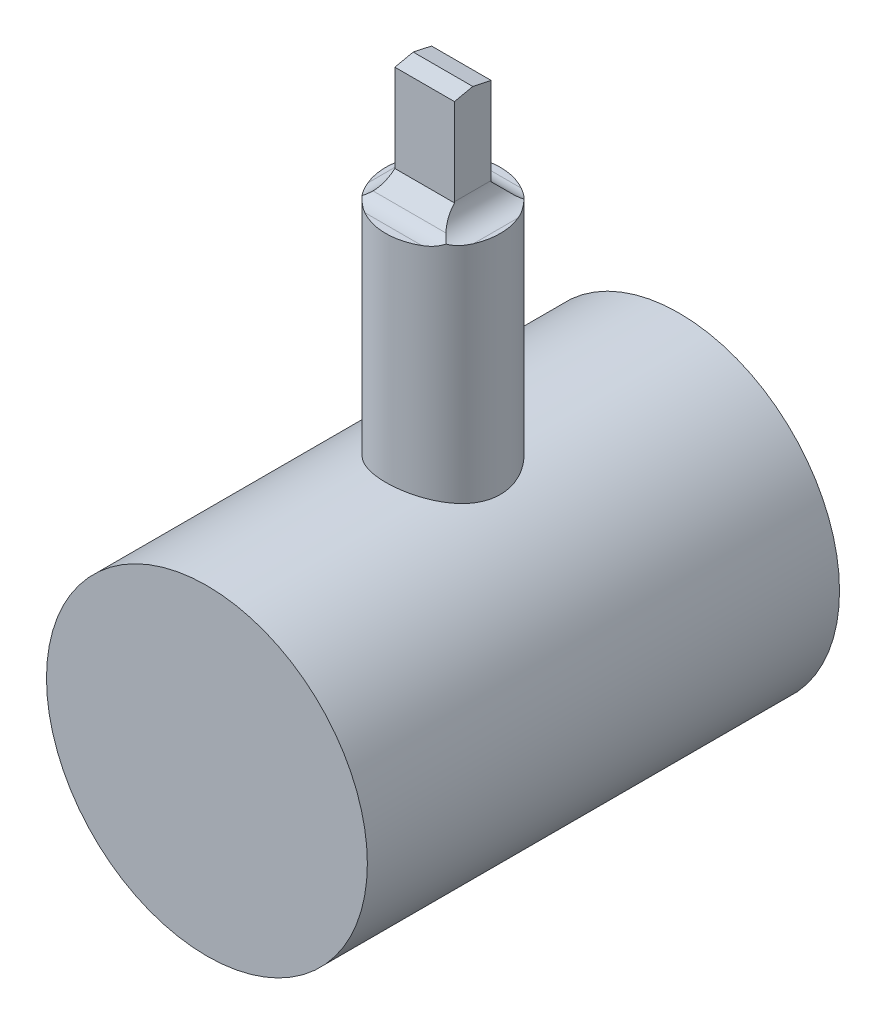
SolidWorks part; units mm, degrees
ref_plane "Front Plane" through (0, 0, 0) normal (0, 0, 1) x (1, 0, 0)
ref_plane "Top Plane" through (0, 0, 0) normal (0, 1, 0) x (1, 0, 0)
ref_plane "Right Plane" through (0, 0, 0) normal (1, 0, 0) x (0, 0, -1)
sketch "Sketch2" plane through (0, 0, 0) normal (0, 0, 1) x (1, 0, 0)
  circle A0 centre (0, 0) radius 4.445
  point P2 (0, 13.5636)
extrude "Boss-Extrude1" add sketch "Sketch2" along normal mid plane 13.081
sketch "Sketch3" plane through (0, 0, 0) normal (0, 1, 0) x (1, 0, 0)
  circle A0 centre (0, 0) radius 1.5875
  dimension "D1" = 3.175
extrude "Boss-Extrude2" add sketch "Sketch3" along normal blind 13.5636
sketch "Sketch4" plane through (0, 0, 0) normal (1, 0, 0) x (0, 0, -1)
  line L0 (0, 13.5636) -> (0, 0) construction
  line L1 (1.5875, 13.5636) -> (-1.5875, 13.5636) construction
  line L2 (-0.508, 11.0236) -> (-1.1139, 10.4177)
  line L4 (-0.508, 13.455) -> (-0.508, 11.0236)
  line L5 (0, 13.5636) -> (-0.508, 13.455)
  line L6 (0.508, 13.455) -> (0.508, 11.0236)
  line L7 (-1.1139, 10.4177) -> (-1.5875, 10.4177)
  line L8 (-1.5875, 13.5636) -> (-1.5875, 4.445) construction
  line L9 (0.508, 11.0236) -> (1.1139, 10.4177)
  line L10 (1.1139, 10.4177) -> (1.5875, 10.4177)
  line L11 (1.5875, 4.445) -> (1.5875, 13.5636) construction
  line L12 (1.5875, 10.4177) -> (2.9822, 10.4177)
  line L13 (2.9822, 10.4177) -> (2.9822, 15.2123)
  line L14 (2.9822, 15.2123) -> (-2.5868, 15.2123)
  line L15 (-2.5868, 15.2123) -> (-2.5868, 10.4177)
  line L16 (-2.5868, 10.4177) -> (-1.5875, 10.4177)
  line L17 (0, 13.5636) -> (0.508, 13.455)
  dimension "D1" = 1.016
  dimension "D2" = 0.508
extrude "Cut-Extrude1" cut sketch "Sketch4" against normal mid plane 13.5636
sketch "Sketch5" plane through (0, 0, 0) normal (0, 0, 1) x (1, 0, 0)
  line L0 (0, 0) -> (0, 13.5636) construction
  line L1 (-1.5875, 13.5636) -> (1.5875, 13.5636) construction
  line L2 (1.1311, 10.4177) -> (-1.1311, 10.4177) construction
  line L3 (-1.5875, 13.5636) -> (-0.8255, 13.5636)
  line L4 (-1.5875, 13.5636) -> (-1.5875, 10.4177)
  line L5 (-1.5875, 10.4177) -> (-0.8255, 10.4177)
  line L6 (-0.8255, 13.5636) -> (-0.8255, 10.4177)
  line L7 (0.8255, 13.5636) -> (0.8255, 10.4177)
  line L8 (1.5875, 10.4177) -> (0.8255, 10.4177)
  line L9 (1.5875, 13.5636) -> (1.5875, 10.4177)
  line L10 (1.5875, 13.5636) -> (0.8255, 13.5636)
  dimension "D1" = 0.762
extrude "Cut-Extrude2" cut sketch "Sketch5" against normal mid plane 13.5636
fillet "Fillet1" radius 0.635 4 edges at (0.8255, 10.4177, 0) (0, 10.4177, -1.1139) (0, 10.4177, 1.1139) (-0.8255, 10.4177, 0)
